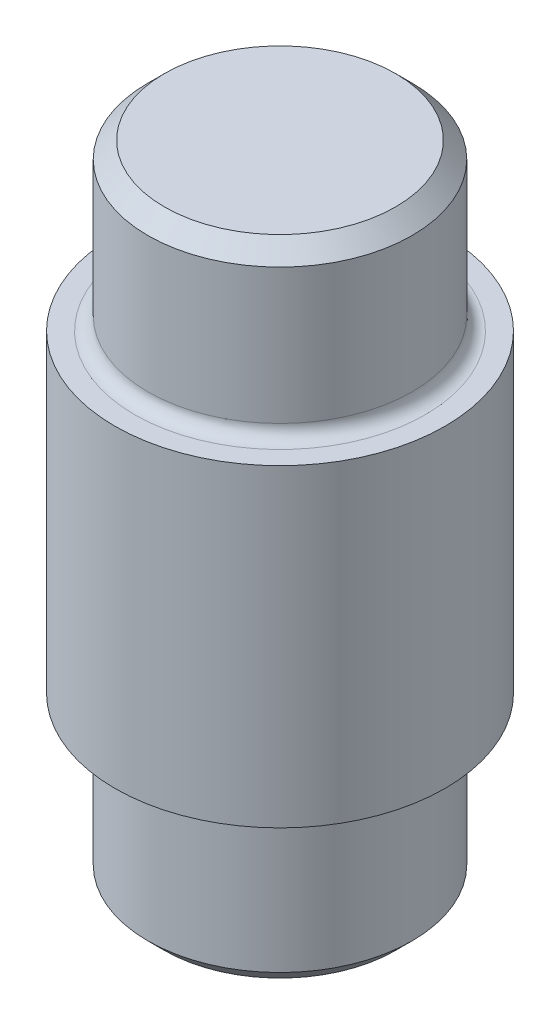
SolidWorks part; units mm, degrees
ref_plane "Plan1" through (0, 0, 0) normal (0, 0, 1) x (1, 0, 0)
ref_plane "Plan2" through (0, 0, 0) normal (0, 1, 0) x (1, 0, 0)
ref_plane "Plan3" through (0, 0, 0) normal (1, 0, 0) x (0, 0, -1)
sketch "Esquisse1" plane through (0, 0, 0) normal (0, 0, 1) x (1, 0, 0)
  line L0 (0, 40) -> (0, -20) construction
  line L1 (0, 0) -> (-4, 0)
  line L2 (-4, 0) -> (-4, 5)
  line L3 (-4, 5) -> (-5, 5)
  line L4 (-5, 5) -> (-5, 14.5)
  line L5 (-5, 14.5) -> (-4, 14.5)
  line L6 (-4, 14.5) -> (-4, 19.5)
  line L7 (-4, 19.5) -> (0, 19.5)
  line L8 (0, 0) -> (0, 19.5)
  dimension "D1" = 8
  dimension "D2" = 10
  dimension "D3" = 5
  dimension "D4" = 9.5
revolve "Base-Révolution" add sketch "Esquisse1" angle 360 about L0
chamfer "Chanfrein1" distance 0.5 angle 45
fillet "Congé1" radius 0.4
